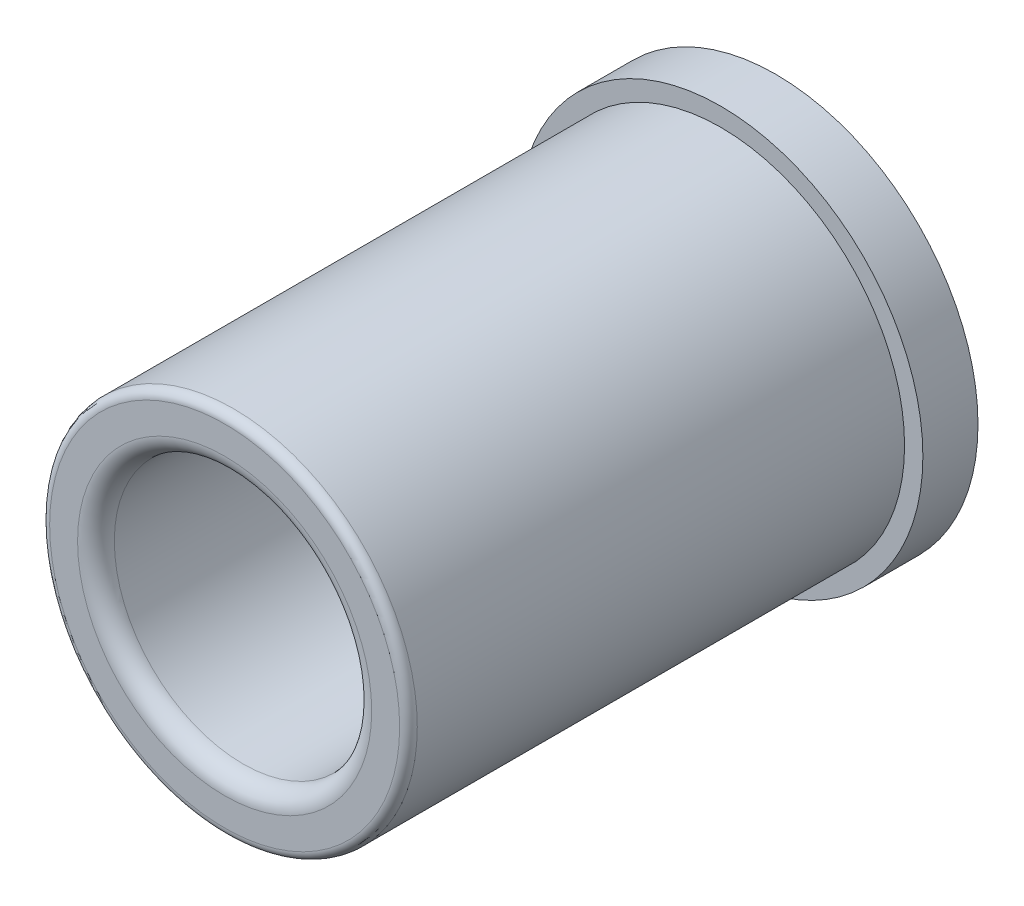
SolidWorks part; units mm, degrees
ref_plane "Plane1" through (0, 0, 0) normal (0, 0, 1) x (1, 0, 0)
ref_plane "Plane2" through (0, 0, 0) normal (0, 1, 0) x (1, 0, 0)
ref_plane "Plane3" through (0, 0, 0) normal (1, 0, 0) x (0, 0, -1)
ref_plane "Plane4" through (0, 0, -4.7625) normal (0, 0, 1) x (1, 0, 0)
sketch "Base" plane through (0, 0, -4.7625) normal (0, 0, 1) x (1, 0, 0)
  circle A0 centre (0, 0) radius 17.4625
  dimension "M" = 34.925
extrude "Shoulder" add sketch "Base" along normal blind 4.7625
sketch "Body" plane through (0, 0, 0) normal (0, 0, 1) x (1, 0, 0)
  circle A0 centre (0, 0) radius 15.8813
  dimension "B" = 31.7627
extrude "Shank" add sketch "Body" along normal blind 42.8625
other "Center"
sketch "C1" plane through (0, 0, -4.7625) normal (0, 0, -1) x (-1, 0, 0)
  circle A0 centre (0, 0) radius 11.1189
  dimension "D" = 22.2377
fillet "Fillet1" radius 1.5875 1 edges at (-11.1189, 0, 42.8625)
fillet "Fillet2" radius 0.762 1 edges at (15.8813, 0, 42.8625)
other "CounterBore" parameters "Depth"=3.1496
sketch "Cbore1" plane through (0, 0, -4.7625) normal (0, 0, -1) x (-1, 0, 0)
  circle A0 centre (0, 0) radius 11.4998
  circle A1 centre (0, 0) radius 11.1189 construction
  dimension "Dia" = 22.9997
chamfer "Chamfer1" distance 0.7937 angle 45 1 edges at (-11.4998, 0, -4.7625)
